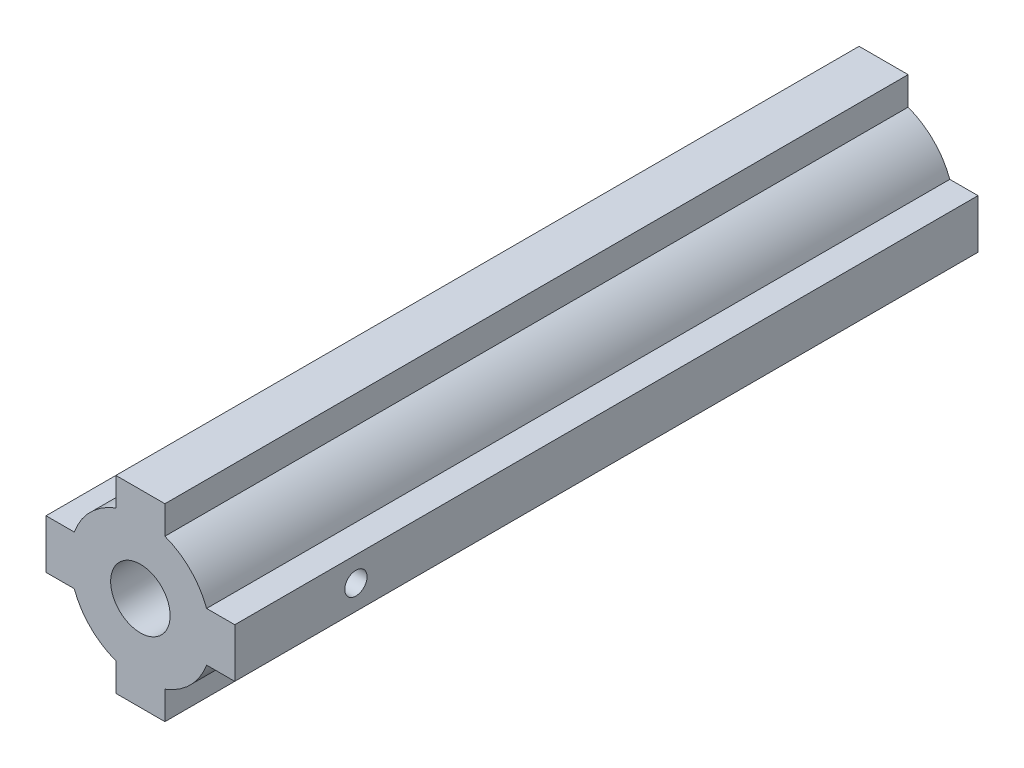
SolidWorks part; units mm, degrees
ref_plane "Plan de face" through (0, 0, 0) normal (0, 0, 1) x (1, 0, 0)
ref_plane "Plan de dessus" through (0, 0, 0) normal (0, 1, 0) x (1, 0, 0)
ref_plane "Plan de droite" through (0, 0, 0) normal (1, 0, 0) x (0, 0, -1)
sketch "Esquisse1" plane through (0, 0, 0) normal (0, 0, 1) x (1, 0, 0)
  line L1 (-3.3, 12.7) -> (3.3, 12.7)
  line L2 (-3.3, 12.7) -> (-3.3, -12.7)
  line L3 (-3.3, -12.7) -> (3.3, -12.7)
  line L4 (3.3, 12.7) -> (3.3, -12.7)
  line L5 (-12.7, 3.3) -> (12.7, 3.3)
  line L6 (-12.7, 3.3) -> (-12.7, -3.3)
  line L7 (-12.7, -3.3) -> (12.7, -3.3)
  line L8 (12.7, 3.3) -> (12.7, -3.3)
  circle A0 centre (0, 0) radius 9.5
  point P7 (0, 12.7)
  point P8 (3.3, 0)
  point P13 (-12.7, 0)
  point P15 (0, -3.3)
  dimension "D1" = 19
  dimension "D2" = 6.6
  dimension "D3" = 25.4
extrude "Boss.-Extru.1" add sketch "Esquisse1" along normal blind 100 contours L2 A0 | L4 A0 L2 | A0 L4 L1 L2 | L4 A0 | A0 L2 L3 L4 | L6 L5 L8 L7
sketch "Esquisse2" plane through (0, 0, 100) normal (0, 0, 1) x (1, 0, 0)
  circle A0 centre (0, 0) radius 4
  dimension "D1" = 8
extrude "Enlèv. mat.-Extru.1" cut sketch "Esquisse2" against normal blind 26
sketch "Esquisse3" plane through (12.7, 0, 0) normal (1, 0, 0) x (0, 0, -1)
  line L0 (-74, 4) -> (-74, -4) construction
  line L1 (-100, 3.3) -> (-100, -3.3) construction
  circle A0 centre (-83.7, 0) radius 1.5
  point P7 (-100, 0)
  dimension "D2" = 3
  dimension "D1" = 9.7
extrude "Enlèv. mat.-Extru.2" cut sketch "Esquisse3" against normal blind 26
sketch "Esquisse4" plane through (0, 0, 0) normal (0, 0, -1) x (-1, 0, 0)
  circle A0 centre (0, 0) radius 3.75
  dimension "D1" = 7.5
extrude "Enlèv. mat.-Extru.3" cut sketch "Esquisse4" against normal blind 26
thread "Filetage1" pitch 1.5 start angle 0, offset 1, length 0, pitch 1.5, diameter 7.5
ref_plane "Plan2" through (3.75, 0, -1) normal (0, -1, 0) x (1, 0, 0)
sketch "Profil de filetage2" plane through (3.75, 0, -1) normal (0, -1, 0) x (1, 0, 0)
  line L0 (0, 0) -> (0, 1.5) construction
  line L1 (0, 0) -> (0.8119, 0.4687)
  line L2 (0.8119, 0.4687) -> (0.8119, 0.6562)
  line L3 (0.8119, 0.6562) -> (0, 1.125)
  line L4 (0.8119, 0.5625) -> (0, 0.5625) construction
  line L11 (0, 0) -> (0, 1.125)
  point P2 (0, 0)
  dimension "Pitch" = 1.5
  dimension "Profile_Angle" = 60
  dimension "Profile_Land" = 0.1875
  dimension "Profile_Height" = 0.8119
